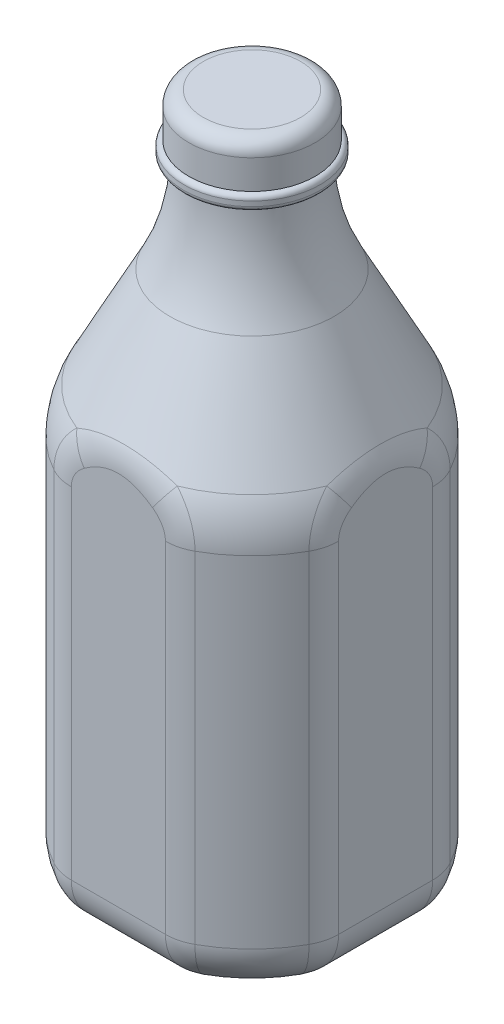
SolidWorks part; units mm, degrees
ref_plane "Front Plane" through (0, 0, 0) normal (0, 0, 1) x (1, 0, 0)
ref_plane "Top Plane" through (0, 0, 0) normal (0, 1, 0) x (1, 0, 0)
ref_plane "Right Plane" through (0, 0, 0) normal (1, 0, 0) x (0, 0, -1)
sketch "Sketch1" plane through (0, 0, 0) normal (0, 0, 1) x (1, 0, 0)
  line L0 (0, 0) -> (0, 130) construction
  line L1 (0, 130) -> (12, 130)
  line L2 (30, 80.0831) -> (30, 0)
  line L3 (30, 0) -> (0, 0)
  line L4 (0, 130) -> (0, 0)
  line L5 (16.9169, 110) -> (27.7202, 89.3564)
  arc A0 (12, 130) -> (16.9169, 110) centre (55.1343, 130) ccw
  arc A2 (27.7202, 89.3564) -> (30, 80.0831) centre (10, 80.0831) cw
  point P11 (30, 85)
  dimension "D2" = 30
  dimension "D6" = 20
  dimension "D1" = 130
  dimension "D3" = 85
  dimension "D4" = 12
  dimension "D5" = 20
revolve "Revolve1" add sketch "Sketch1" angle 360 about L0
fillet "Fillet2" radius 10 1 edges at (0, 0, -30)
sketch "Sketch6" plane through (0, 130, 0) normal (0, 1, 0) x (1, 0, 0)
  line L1 (-27.5, -27.5) -> (27.5, -27.5)
  line L2 (-27.5, -27.5) -> (-27.5, 27.5)
  line L3 (-27.5, 27.5) -> (27.5, 27.5)
  line L4 (27.5, -27.5) -> (27.5, 27.5)
  line L5 (-27.5, -27.5) -> (27.5, 27.5) construction
  line L6 (-27.5, 27.5) -> (27.5, -27.5) construction
  point P0 (0, 0)
  dimension "D1" = 55
extrude "Cut-Extrude1" cut sketch "Sketch6" against normal through all flip side to cut
fillet "Fillet3" radius 10 24 edges at (0.4796, 16.6096, 27.5) (-0.4796, 16.6096, -27.5) (27.5, 16.6096, -0.4796) (-27.5, 16.6096, 0.4796) (-27.5, 45.0415, -11.9896) (-27.5, 45.0415, 11.9896) (-27.5, 89.7631, -0.6361) (27.5, 89.7631, 0.6361) (27.5, 45.0415, 11.9896) (27.5, 45.0415, -11.9896) (0.6361, 89.7631, -27.5) (11.9896, 45.0415, -27.5) (-11.9896, 45.0415, -27.5) (-0.6361, 89.7631, 27.5) (-11.9896, 45.0415, 27.5) (11.9896, 45.0415, 27.5) (-27.5, 84.6054, -10.6273) (-27.5, 84.6827, 10.577) (27.5, 84.6054, 10.6273) (27.5, 84.6827, -10.577) (10.6273, 84.6054, -27.5) (-10.577, 84.6827, -27.5) (-10.6273, 84.6054, 27.5) (10.577, 84.6827, 27.5)
sketch "Sketch7" plane through (0, 130, 0) normal (0, 1, 0) x (1, 0, 0)
  circle A2 centre (0, 0) radius 14
  circle A3 centre (0, 0) radius 14
  dimension "D1" = 2
extrude "Boss-Extrude1" add sketch "Sketch7" along normal blind 3 separate body
sketch "Sketch8" plane through (0, 133, 0) normal (0, 1, 0) x (1, 0, 0)
  circle A2 centre (0, 0) radius 13
  circle A3 centre (0, 0) radius 13
  dimension "D1" = 1
extrude "Boss-Extrude2" add sketch "Sketch8" along normal blind 9
fillet "Fillet4" radius 1 2 edges at (0, 130, 14) (0, 133, 14)
fillet "Fillet6" radius 3 1 edges at (0, 142, 13)
